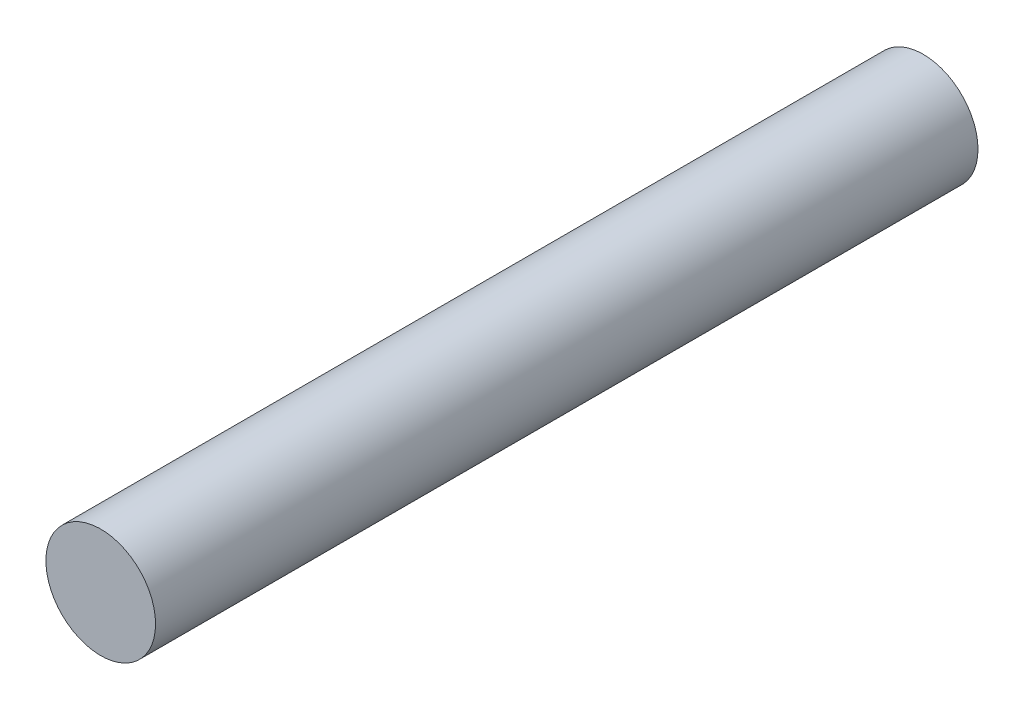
SolidWorks part; units mm, degrees
ref_plane "Front Plane" through (0, 0, 0) normal (0, 0, 1) x (1, 0, 0)
ref_plane "Top Plane" through (0, 0, 0) normal (0, 1, 0) x (1, 0, 0)
ref_plane "Right Plane" through (0, 0, 0) normal (1, 0, 0) x (0, 0, -1)
sketch "Sketch1" plane through (0, 0, 0) normal (0, 0, 1) x (1, 0, 0)
  circle A0 centre (0, 0) radius 30
  dimension "D1" = 60
extrude "Boss-Extrude1" add sketch "Sketch1" against normal blind 450
